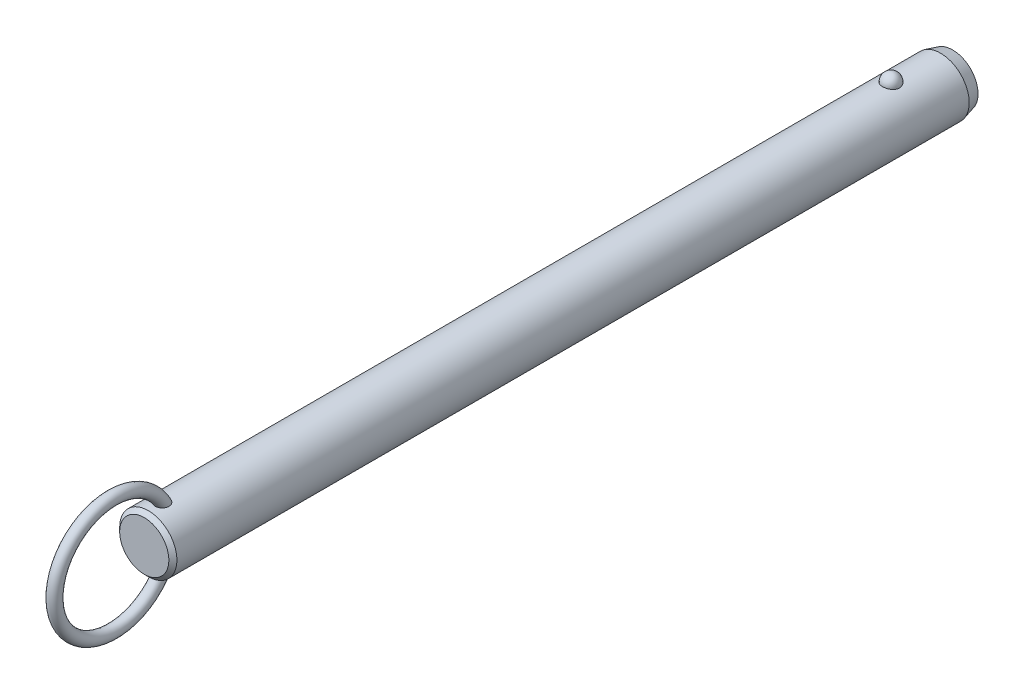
SolidWorks part; units mm, degrees
ref_plane "Front Plane" through (0, 0, 0) normal (0, 0, 1) x (1, 0, 0)
ref_plane "Top Plane" through (0, 0, 0) normal (0, 1, 0) x (1, 0, 0)
ref_plane "Right Plane" through (0, 0, 0) normal (1, 0, 0) x (0, 0, -1)
sketch "Sketch2" plane through (0, 0, 0) normal (0, 0, 1) x (1, 0, 0)
  circle A0 centre (0, 0) radius 7.1
  point P3 (0, 7.1)
  dimension "D1" = 14.2
extrude "Boss-Extrude1" add sketch "Sketch2" along normal blind 175.3
sketch "Sketch3" plane through (0, 0, 0) normal (0, 0, -1) x (-1, 0, 0)
  circle A0 centre (0, 0) radius 7.1
  dimension "D1" = 14.2
extrude "Boss-Extrude2" add sketch "Sketch3" along normal blind 17.4
chamfer "Chamfer1" distance 3 angle 15 1 edges at (-7.1, 0, -17.4)
sketch "Sketch12" plane through (0, 0, 0) normal (1, 0, 0) x (0, 0, -1)
  line L0 (-175.3, 7.1) -> (-175.3, -7.1) construction
  point P0 (-175.3, 0)
sketch "Sketch13" plane through (0, 0, 0) normal (1, 0, 0) x (0, 0, -1)
  circle A0 centre (-191.15, 0) radius 15.85
  point P2 (-175.3, 0)
  dimension "D1" = 31.7
sketch "Sketch14" plane through (0, 0, 0) normal (0, 1, 0) x (1, 0, 0)
  circle A0 centre (0, -176.8) radius 1.5
  point P2 (0, -175.3)
  dimension "D1" = 3
sweep "Sweep1" add profiles "Sketch14" path "Sketch13"
sketch "Sketch15" plane through (0, 0, 175.3) normal (0, 0, 1) x (1, 0, 0)
  circle A0 centre (0, 0) radius 7.1
  dimension "D1" = 14.2
extrude "Boss-Extrude3" add sketch "Sketch15" along normal blind 7.92
chamfer "Chamfer2" distance 1 angle 45 1 edges at (7.1, 0, 183.22)
sketch "Sketch18" plane through (0, 0, 0) normal (1, 0, 0) x (0, 0, -1)
  line L0 (14.4, 7.1) -> (-176.9792, 7.1) construction
  line L1 (2.1, 9.2) -> (2.1, 5)
  line L2 (-176.9792, -7.1) -> (14.4, -7.1) construction
  arc A0 (2.1, 9.2) -> (2.1, 5) centre (2.1, 7.1) ccw
  point P4 (0, 7.1)
  dimension "D1" = 16.3
revolve "Revolve1" add sketch "Sketch18" angle 360 about L1
